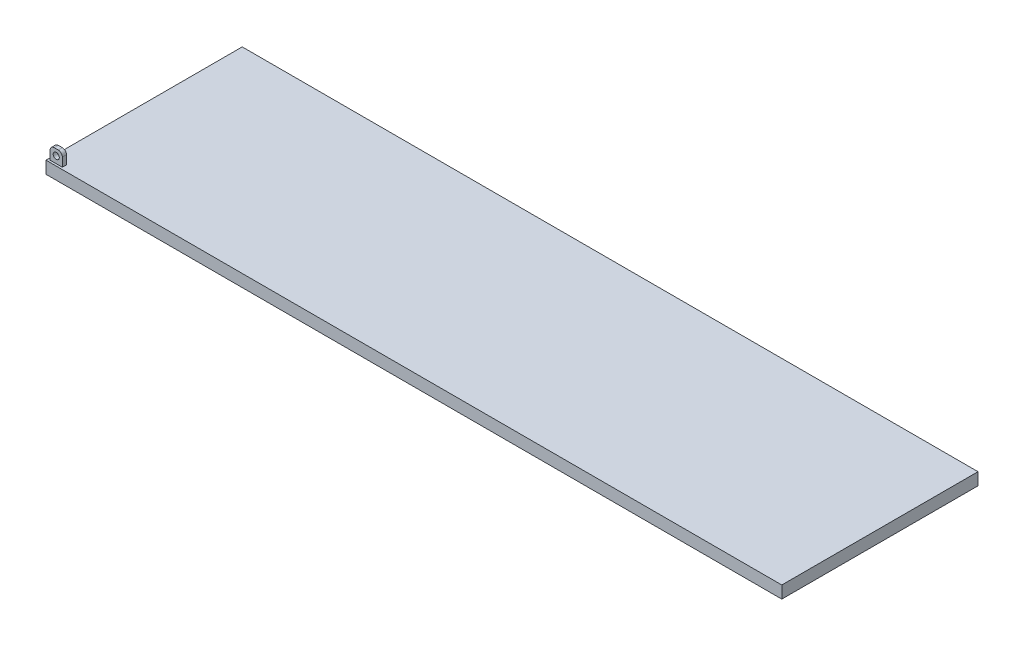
SolidWorks part; units mm, degrees
ref_plane "Front Plane" through (0, 0, 0) normal (0, 0, 1) x (1, 0, 0)
ref_plane "Top Plane" through (0, 0, 0) normal (0, 1, 0) x (1, 0, 0)
ref_plane "Right Plane" through (0, 0, 0) normal (1, 0, 0) x (0, 0, -1)
sketch "Sketch1" plane through (0, 0, 0) normal (0, 1, 0) x (1, 0, 0)
  line L1 (-4572, 1219.2) -> (4572, 1219.2)
  line L2 (-4572, 1219.2) -> (-4572, -1219.2)
  line L3 (-4572, -1219.2) -> (4572, -1219.2)
  line L4 (4572, 1219.2) -> (4572, -1219.2)
  line L5 (-4572, 1219.2) -> (4572, -1219.2) construction
  line L6 (-4572, -1219.2) -> (4572, 1219.2) construction
  point P0 (0, 0)
  dimension "D1" = 2438.4
  dimension "D2" = 9144
extrude "Boss-Extrude1" add sketch "Sketch1" along normal blind 152.4
sketch "Sketch2" plane through (0, 152.4, 0) normal (0, 1, 0) x (1, 0, 0)
  line L0 (-4572, -1219.2) -> (4572, -1219.2) construction
  line L1 (-4546.6, -1143) -> (-4394.2, -1143)
  line L2 (-4546.6, -1143) -> (-4546.6, -1193.8)
  line L3 (-4546.6, -1193.8) -> (-4394.2, -1193.8)
  line L4 (-4394.2, -1143) -> (-4394.2, -1193.8)
  line L5 (-4546.6, -1143) -> (-4394.2, -1193.8) construction
  line L6 (-4546.6, -1193.8) -> (-4394.2, -1143) construction
  line L7 (-4572, 1219.2) -> (-4572, -1219.2) construction
  point P0 (-4470.4, -1168.4)
  dimension "D1" = 50.8
  dimension "D2" = 152.4
  dimension "D3" = 50.8
  dimension "D4" = 101.6
extrude "Lifting_ring" add sketch "Sketch2" along normal blind 159.8665
fillet "Fillet1" radius 50.8 2 edges at (-4394.2, 312.2665, 1168.4) (-4546.6, 312.2665, 1168.4)
sketch "Sketch3" plane through (0, 0, 1193.8) normal (0, 0, 1) x (1, 0, 0)
  line L0 (-4546.6, 261.4665) -> (-4546.6, 152.4) construction
  circle A0 centre (-4470.4, 237.1807) radius 38.1
  dimension "D1" = 76.2
  dimension "D2" = 76.2
extrude "Cut-Extrude1" cut sketch "Sketch3" against normal up to next
sketch "Location_Sketch4" plane through (0, 152.4, 0) normal (0, 1, 0) x (1, 0, 0)
  line L0 (-4572, -1219.2) -> (4572, -1219.2) construction
  line L1 (4572, -1219.2) -> (4572, 1219.2) construction
  line L2 (4572, 1219.2) -> (-4572, 1219.2) construction
  line L3 (-4572, 1219.2) -> (-4572, -1219.2) construction
  point P0 (3352.8, 0)
  point P1 (1397, 660.4)
  point P2 (-254, 660.4)
  point P3 (-2794, -558.8)
  point P12 (508, -965.2)
  dimension "D1" = 1219.2
  dimension "D2" = 1219.2
  dimension "D3" = 3175
  dimension "D4" = 4826
  dimension "D5" = 558.8
  dimension "D6" = 1778
  dimension "D7" = 1778
  dimension "D8" = 254
  dimension "D9" = 5080
